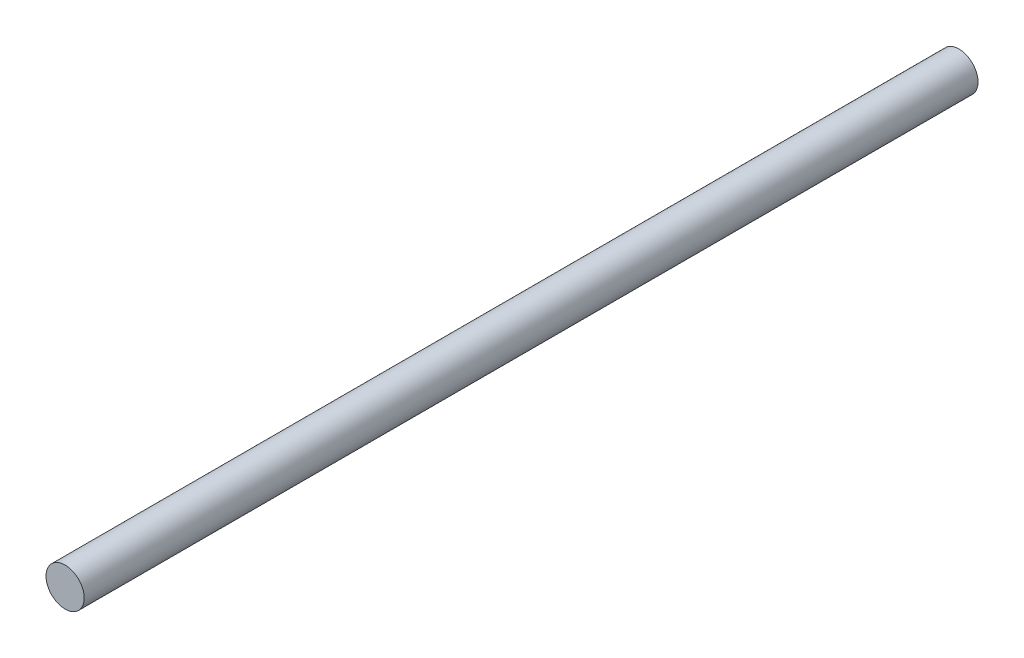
SolidWorks part; units mm, degrees
ref_plane "Front" through (0, 0, 0) normal (0, 0, 1) x (1, 0, 0)
ref_plane "Top" through (0, 0, 0) normal (0, 1, 0) x (1, 0, 0)
ref_plane "Right" through (0, 0, 0) normal (1, 0, 0) x (0, 0, -1)
sketch "Sketch1" plane through (0, 0, 0) normal (0, 0, 1) x (1, 0, 0)
  circle A0 centre (0, 0) radius 0.8141
extrude "Extrude1" add sketch "Sketch1" along normal blind 38.1
